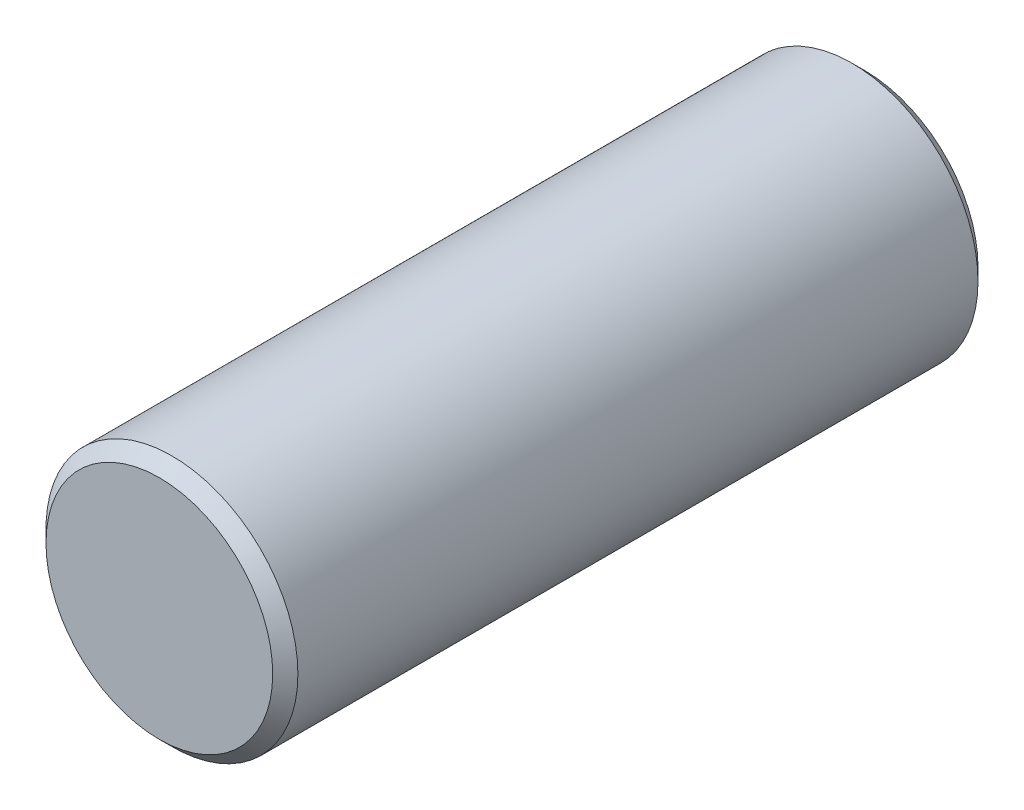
SolidWorks part; units mm, degrees
ref_plane "Plan1" through (0, 0, 0) normal (0, 0, 1) x (1, 0, 0)
ref_plane "Plan2" through (0, 0, 0) normal (0, 1, 0) x (1, 0, 0)
ref_plane "Plan3" through (0, 0, 0) normal (1, 0, 0) x (0, 0, -1)
sketch "Esquisse1" plane through (0, 0, 0) normal (0, 0, 1) x (1, 0, 0)
  circle A0 centre (0, 0) radius 5
  dimension "D1" = 10
extrude "Base-Extrusion" add sketch "Esquisse1" along normal blind 28
chamfer "Chanfrein1" distance 0.5 angle 45
